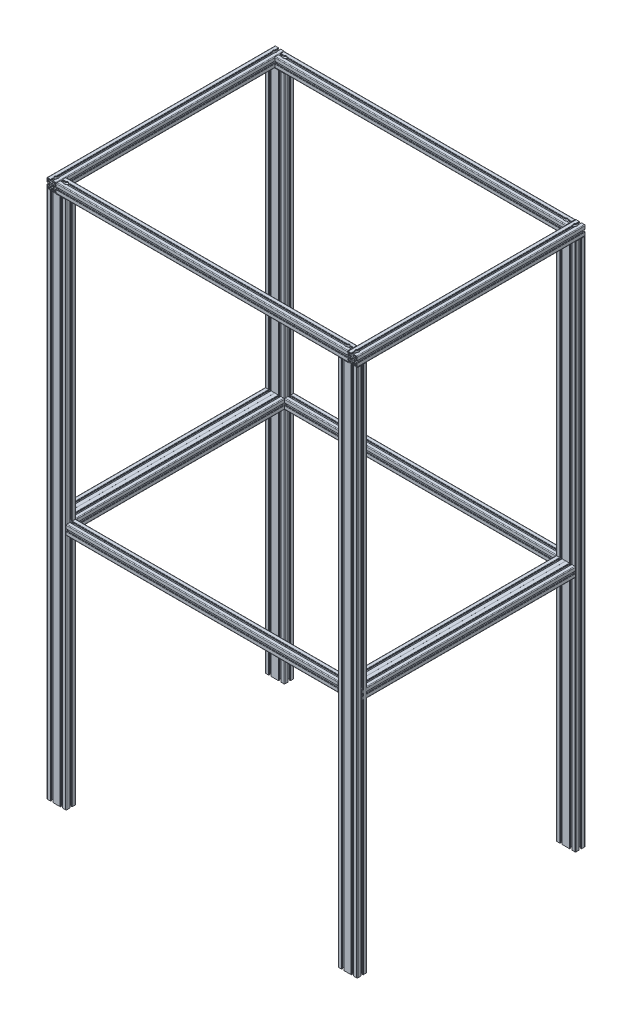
SolidWorks part; units mm, degrees
ref_plane "Ebene vorne" through (0, 0, 0) normal (0, 0, 1) x (1, 0, 0)
ref_plane "Ebene oben" through (0, 0, 0) normal (0, 1, 0) x (1, 0, 0)
ref_plane "Ebene rechts" through (0, 0, 0) normal (1, 0, 0) x (0, 0, -1)
sketch3d "3D-Skizze2"
  line L0 (600, 1200, -450) -> (600, -1000, -450)
  line L1 (-600, 0, 450) -> (-600, 0, -450)
  line L2 (-600, 0, 450) -> (600, 0, 450)
  line L3 (600, 0, 450) -> (600, 0, -450)
  line L4 (-600, 0, -450) -> (600, 0, -450)
  line L5 (-600, 0, 450) -> (600, 0, -450) construction
  line L6 (600, 0, 450) -> (-600, 0, -450) construction
  line L7 (-600, 1200, -450) -> (-600, -1000, -450)
  line L8 (600, 1200, 450) -> (600, -1000, 450)
  line L9 (-600, 1200, 450) -> (-600, -1000, 450)
  line L10 (600, 1200, -450) -> (600, 1200, 450) construction
  line L11 (-600, 1200, -450) -> (-600, 1200, 450) construction
  line L12 (600, 1200, 450) -> (-600, 1200, 450) construction
  line L13 (600, 1200, -450) -> (-600, 1200, -450) construction
  line L14 (-620, 1200, -450) -> (620, 1200, -450)
  line L15 (-620, 1200, 450) -> (620, 1200, 450)
  line L16 (-620, 1200, -450) -> (-620, 1200, 450)
  line L17 (620, 1200, -450) -> (620, 1200, 450)
  line L18 (620, 1200, 450) -> (600, 1200, 450)
  point P0 (0, 0, 0)
  dimension "D1" = 1200
  dimension "D2" = 900
  dimension "D3" = 1000
  dimension "D4" = 2200
  dimension "D5" = 20
  dimension "D6" = 20
other "Strukturbauteil3"
ref_plane "Ebene3" through (-600, 1200, 450) normal (0, -1, 0) x (1, 0, 0)
sketch "Skizze1" plane through (-600, 1200, 450) normal (0, -1, 0) x (1, 0, 0)
  line L0 (-33.5, 16) -> (-31.6865, 16)
  line L1 (-33.508, 16.2) -> (-31.6235, 16.2)
  line L2 (33.5, 16) -> (31.6865, 16)
  line L3 (33.508, 15.8) -> (31.7274, 15.8)
  line L4 (36, 15.8) -> (31.6865, 15.8) construction
  line L5 (36, 16) -> (31.6865, 16) construction
  line L6 (31.6865, -16) -> (33.5, -16)
  line L7 (-16.6, 0) -> (-12.25, 0)
  line L8 (-16.6059, -0.2) -> (-12.25, -0.2)
  line L9 (12.25, 0) -> (16.6, 0)
  line L10 (31.7274, -15.8) -> (33.508, -15.8)
  line L11 (-20, 0) -> (20, 0) construction
  line L12 (-20, -0.2) -> (20, -0.2) construction
  line L13 (12.25, -0.2) -> (16.6059, -0.2)
  line L14 (-33.5061, -15.8) -> (-31.7274, -15.8)
  line L15 (-33.4983, -15.9669) -> (-31.7274, -15.9669)
  line L16 (-31.7274, -15.9669) -> (-31.7274, -17.5)
  line L17 (-12.25, -0.2) -> (-12.25, -4.8728)
  line L18 (12.25, 0) -> (12.25, 6.1155)
  line L19 (0, -17.5) -> (0, -20)
  line L20 (-0.1, -17.5) -> (-0.1, -20)
  line L21 (0, -17.5) -> (2.68, -17.5)
  line L22 (-0.1, -20) -> (-14.9, -20)
  line L122 (-17.1716, 4.2426) -> (-18.4093, 3.0049)
  line L123 (-21.5907, 3.0049) -> (-22.8284, 4.2426)
  line L124 (-24.2426, 2.8284) -> (-23.0049, 1.5907)
  line L125 (-23.0049, -1.5907) -> (-24.2426, -2.8284)
  line L126 (-22.8284, -4.2426) -> (-21.5907, -3.0049)
  line L127 (-18.4093, -3.0049) -> (-17.1716, -4.2426)
  line L128 (-15.7574, -2.8284) -> (-16.9951, -1.5907)
  line L129 (-16.9951, 1.5907) -> (-15.7574, 2.8284)
  line L130 (22.8284, 4.2426) -> (21.5907, 3.0049)
  line L131 (18.4093, 3.0049) -> (17.1716, 4.2426)
  line L132 (15.7574, 2.8284) -> (16.9951, 1.5907)
  line L133 (16.9951, -1.5907) -> (15.7574, -2.8284)
  line L134 (17.1716, -4.2426) -> (18.4093, -3.0049)
  line L135 (21.5907, -3.0049) -> (22.8284, -4.2426)
  line L136 (24.2426, -2.8284) -> (23.0049, -1.5907)
  line L137 (23.0049, 1.5907) -> (24.2426, 2.8284)
  line L138 (26.5, 15.5) -> (24.6, 15.5)
  line L139 (24.1, 16) -> (24.1, 19)
  line L140 (25.1, 20) -> (37, 20)
  line L141 (40, 17) -> (40, 5.1)
  line L142 (39, 4.1) -> (36, 4.1)
  line L143 (35.5, 4.6) -> (35.5, 6.5)
  line L144 (36, 7) -> (37, 7)
  line L145 (37.5, 7.5) -> (37.5, 9.75)
  line L146 (35.5, 11.75) -> (34.5784, 11.75)
  line L147 (33.1642, 11.1642) -> (28.7787, 6.7787)
  line L148 (27.9, 4.6574) -> (27.9, 0.5)
  line L149 (27.9, 0.5) -> (27.4, 0)
  line L150 (27.4, 0) -> (27.9, -0.5)
  line L151 (27.9, -0.5) -> (27.9, -4.6574)
  line L152 (28.7787, -6.7787) -> (33.1642, -11.1642)
  line L153 (34.5784, -11.75) -> (35.5, -11.75)
  line L154 (37.5, -9.75) -> (37.5, -7.5)
  line L155 (37, -7) -> (36, -7)
  line L156 (35.5, -6.5) -> (35.5, -4.6)
  line L157 (36, -4.1) -> (39, -4.1)
  line L158 (40, -5.1) -> (40, -17)
  line L159 (37, -20) -> (25.1, -20)
  line L160 (24.1, -19) -> (24.1, -16)
  line L161 (24.6, -15.5) -> (26.5, -15.5)
  line L162 (27, -16) -> (27, -17)
  line L163 (27.5, -17.5) -> (29.75, -17.5)
  line L164 (31.75, -15.5) -> (31.75, -14.5784)
  line L165 (31.1642, -13.1642) -> (26.7787, -8.7787)
  line L166 (24.6574, -7.9) -> (20.5, -7.9)
  line L167 (20.5, -7.9) -> (20, -7.4)
  line L168 (20, -7.4) -> (19.5, -7.9)
  line L169 (19.5, -7.9) -> (15.3426, -7.9)
  line L170 (13.2213, -8.7787) -> (8.8358, -13.1642)
  line L171 (8.25, -14.5784) -> (8.25, -15.5)
  line L172 (10.25, -17.5) -> (12.5, -17.5)
  line L173 (13, -17) -> (13, -16)
  line L174 (13.5, -15.5) -> (15.4, -15.5)
  line L175 (15.9, -16) -> (15.9, -19)
  line L176 (14.9, -20) -> (0, -20)
  line L177 (-15.9, -19) -> (-15.9, -16)
  line L178 (-15.4, -15.5) -> (-13.5, -15.5)
  line L179 (-13, -16) -> (-13, -17)
  line L180 (-12.5, -17.5) -> (-10.25, -17.5)
  line L181 (-8.25, -15.5) -> (-8.25, -14.5784)
  line L182 (-8.8358, -13.1642) -> (-13.2213, -8.7787)
  line L183 (-15.3426, -7.9) -> (-19.5, -7.9)
  line L184 (-19.5, -7.9) -> (-20, -7.4)
  line L185 (-20, -7.4) -> (-20.5, -7.9)
  line L186 (-20.5, -7.9) -> (-24.6574, -7.9)
  line L187 (-26.7787, -8.7787) -> (-31.1642, -13.1642)
  line L188 (-31.75, -14.5784) -> (-31.75, -15.5)
  line L189 (-31.7274, -17.5) -> (-27.5, -17.5)
  line L190 (-27, -17) -> (-27, -16)
  line L191 (-26.5, -15.5) -> (-24.6, -15.5)
  line L192 (-24.1, -16) -> (-24.1, -19)
  line L193 (-25.1, -20) -> (-37, -20)
  line L194 (-40, -17) -> (-40, -5.1)
  line L195 (-39, -4.1) -> (-36, -4.1)
  line L196 (-35.5, -4.6) -> (-35.5, -6.5)
  line L197 (-36, -7) -> (-37, -7)
  line L198 (-37.5, -7.5) -> (-37.5, -9.75)
  line L199 (-35.5, -11.75) -> (-34.5784, -11.75)
  line L200 (-33.1642, -11.1642) -> (-28.7787, -6.7787)
  line L201 (-27.9, -4.6574) -> (-27.9, -0.5)
  line L202 (-27.9, -0.5) -> (-27.4, 0)
  line L203 (-27.4, 0) -> (-27.9, 0.5)
  line L204 (-27.9, 0.5) -> (-27.9, 4.6574)
  line L205 (-28.7787, 6.7787) -> (-33.1642, 11.1642)
  line L206 (-34.5784, 11.75) -> (-35.5, 11.75)
  line L207 (-37.5, 9.75) -> (-37.5, 7.5)
  line L208 (-37, 7) -> (-36, 7)
  line L209 (-35.5, 6.5) -> (-35.5, 4.6)
  line L210 (-36, 4.1) -> (-39, 4.1)
  line L211 (-40, 5.1) -> (-40, 17)
  line L212 (-37, 20) -> (-25.1, 20)
  line L213 (-24.1, 19) -> (-24.1, 16)
  line L214 (-24.6, 15.5) -> (-26.5, 15.5)
  line L215 (-27, 16) -> (-27, 17)
  line L216 (-27.5, 17.5) -> (-29.75, 17.5)
  line L217 (-31.75, 15.5) -> (-31.75, 14.5784)
  line L218 (-31.1642, 13.1642) -> (-26.7787, 8.7787)
  line L219 (-24.6574, 7.9) -> (-20.5, 7.9)
  line L220 (-20.5, 7.9) -> (-20, 7.4)
  line L221 (-20, 7.4) -> (-19.5, 7.9)
  line L222 (-19.5, 7.9) -> (-15.3426, 7.9)
  line L223 (-13.2213, 8.7787) -> (-8.8358, 13.1642)
  line L224 (-8.25, 14.5784) -> (-8.25, 15.5)
  line L225 (-10.25, 17.5) -> (-12.5, 17.5)
  line L226 (-13, 17) -> (-13, 16)
  line L227 (-13.5, 15.5) -> (-15.4, 15.5)
  line L228 (-15.9, 16) -> (-15.9, 19)
  line L229 (-14.9, 20) -> (14.9, 20)
  line L230 (15.9, 19) -> (15.9, 16)
  line L231 (15.4, 15.5) -> (13.5, 15.5)
  line L232 (13, 16) -> (13, 17)
  line L233 (12.5, 17.5) -> (10.25, 17.5)
  line L234 (8.25, 15.5) -> (8.25, 14.5784)
  line L235 (8.8358, 13.1642) -> (13.2213, 8.7787)
  line L236 (15.3426, 7.9) -> (19.5, 7.9)
  line L237 (19.5, 7.9) -> (20, 7.4)
  line L238 (20, 7.4) -> (20.5, 7.9)
  line L239 (20.5, 7.9) -> (24.6574, 7.9)
  line L240 (26.7787, 8.7787) -> (31.1642, 13.1642)
  line L241 (31.75, 14.5784) -> (31.75, 15.5)
  line L242 (29.75, 17.5) -> (27.5, 17.5)
  line L243 (27, 17) -> (27, 16)
  line L245 (12.25, -6.1155) -> (12.25, -0.2)
  line L257 (5.68, 13.5139) -> (5.68, 14.5)
  line L258 (2.68, 17.5) -> (-2.68, 17.5)
  line L259 (-5.68, 14.5) -> (-5.68, 13.5139)
  line L260 (-6.2658, 12.0997) -> (-11.3713, 6.9942)
  line L261 (-12.25, 4.8728) -> (-12.25, 0)
  line L262 (-11.3713, -6.9942) -> (-6.2658, -12.0997)
  line L263 (-5.68, -13.5139) -> (-5.68, -14.5)
  line L264 (-2.68, -17.5) -> (-0.1, -17.5)
  line L265 (5.68, -14.5) -> (5.68, -13.5139)
  line L266 (6.2658, -12.0997) -> (12.25, -6.1155)
  line L268 (12.25, 6.1155) -> (6.2658, 12.0997)
  arc A0 (-31.6865, 16) -> (-31.75, 15.5) centre (-29.75, 15.5) ccw
  arc A1 (-33.508, 16.2) -> (-33.5, 16) centre (-36, 16) ccw
  arc A2 (33.5, 16) -> (33.508, 15.8) centre (36, 16) cw
  arc A3 (31.6865, 16) -> (29.75, 17.5) centre (29.75, 15.5) ccw
  arc A4 (33.5, -16) -> (33.508, -15.8) centre (36, -16) ccw
  arc A5 (31.7274, -15.8) -> (31.75, -15.5) centre (29.75, -15.5) ccw
  arc A6 (-33.5061, -15.8) -> (-33.4983, -15.9669) centre (-35.9991, -15.9999) ccw
  arc A8 (-16.6, 0) -> (-16.9951, 1.5907) centre (-20, 0) ccw
  arc A9 (16.6059, -0.2) -> (16.9951, -1.5907) centre (20, 0) ccw
  circle A108 centre (36, -16) radius 2.5 construction
  circle A109 centre (36, 16) radius 2.5 construction
  arc A112 (-18.4093, 3.0049) -> (-21.5907, 3.0049) centre (-20, 0) ccw
  arc A113 (-22.8284, 4.2426) -> (-24.2426, 2.8284) centre (-23.5355, 3.5355) ccw
  arc A114 (-23.0049, 1.5907) -> (-23.0049, -1.5907) centre (-20, 0) ccw
  arc A115 (-24.2426, -2.8284) -> (-22.8284, -4.2426) centre (-23.5355, -3.5355) ccw
  arc A116 (-21.5907, -3.0049) -> (-18.4093, -3.0049) centre (-20, 0) ccw
  arc A117 (-17.1716, -4.2426) -> (-15.7574, -2.8284) centre (-16.4645, -3.5355) ccw
  arc A118 (-16.9951, -1.5907) -> (-16.6059, -0.2) centre (-20, 0) ccw
  arc A119 (-15.7574, 2.8284) -> (-17.1716, 4.2426) centre (-16.4645, 3.5355) ccw
  arc A120 (21.5907, 3.0049) -> (18.4093, 3.0049) centre (20, 0) ccw
  arc A121 (17.1716, 4.2426) -> (15.7574, 2.8284) centre (16.4645, 3.5355) ccw
  arc A122 (16.9951, 1.5907) -> (16.6, 0) centre (20, 0) ccw
  arc A123 (15.7574, -2.8284) -> (17.1716, -4.2426) centre (16.4645, -3.5355) ccw
  arc A124 (18.4093, -3.0049) -> (21.5907, -3.0049) centre (20, 0) ccw
  arc A125 (22.8284, -4.2426) -> (24.2426, -2.8284) centre (23.5355, -3.5355) ccw
  arc A126 (23.0049, -1.5907) -> (23.0049, 1.5907) centre (20, 0) ccw
  arc A127 (24.2426, 2.8284) -> (22.8284, 4.2426) centre (23.5355, 3.5355) ccw
  arc A128 (24.1, 16) -> (24.6, 15.5) centre (24.6, 16) ccw
  arc A129 (25.1, 20) -> (24.1, 19) centre (25.1, 19) ccw
  arc A130 (40, 17) -> (37, 20) centre (37, 17) ccw
  arc A131 (39, 4.1) -> (40, 5.1) centre (39, 5.1) ccw
  arc A132 (35.5, 4.6) -> (36, 4.1) centre (36, 4.6) ccw
  arc A133 (36, 7) -> (35.5, 6.5) centre (36, 6.5) ccw
  arc A134 (37, 7) -> (37.5, 7.5) centre (37, 7.5) ccw
  arc A135 (37.5, 9.75) -> (35.5, 11.75) centre (35.5, 9.75) ccw
  arc A136 (34.5784, 11.75) -> (33.1642, 11.1642) centre (34.5784, 9.75) ccw
  arc A137 (28.7787, 6.7787) -> (27.9, 4.6574) centre (30.9, 4.6574) ccw
  arc A138 (27.9, -4.6574) -> (28.7787, -6.7787) centre (30.9, -4.6574) ccw
  arc A139 (33.1642, -11.1642) -> (34.5784, -11.75) centre (34.5784, -9.75) ccw
  arc A140 (35.5, -11.75) -> (37.5, -9.75) centre (35.5, -9.75) ccw
  arc A141 (37.5, -7.5) -> (37, -7) centre (37, -7.5) ccw
  arc A142 (35.5, -6.5) -> (36, -7) centre (36, -6.5) ccw
  arc A143 (36, -4.1) -> (35.5, -4.6) centre (36, -4.6) ccw
  arc A144 (40, -5.1) -> (39, -4.1) centre (39, -5.1) ccw
  arc A145 (37, -20) -> (40, -17) centre (37, -17) ccw
  arc A146 (24.1, -19) -> (25.1, -20) centre (25.1, -19) ccw
  arc A147 (24.6, -15.5) -> (24.1, -16) centre (24.6, -16) ccw
  arc A148 (27, -16) -> (26.5, -15.5) centre (26.5, -16) ccw
  arc A149 (27, -17) -> (27.5, -17.5) centre (27.5, -17) ccw
  arc A150 (29.75, -17.5) -> (31.6865, -16) centre (29.75, -15.5) ccw
  arc A151 (31.75, -14.5784) -> (31.1642, -13.1642) centre (29.75, -14.5784) ccw
  arc A152 (26.7787, -8.7787) -> (24.6574, -7.9) centre (24.6574, -10.9) ccw
  arc A153 (15.3426, -7.9) -> (13.2213, -8.7787) centre (15.3426, -10.9) ccw
  arc A154 (8.8358, -13.1642) -> (8.25, -14.5784) centre (10.25, -14.5784) ccw
  arc A155 (8.25, -15.5) -> (10.25, -17.5) centre (10.25, -15.5) ccw
  arc A156 (12.5, -17.5) -> (13, -17) centre (12.5, -17) ccw
  arc A157 (13.5, -15.5) -> (13, -16) centre (13.5, -16) ccw
  arc A158 (15.9, -16) -> (15.4, -15.5) centre (15.4, -16) ccw
  arc A159 (14.9, -20) -> (15.9, -19) centre (14.9, -19) ccw
  arc A160 (-15.9, -19) -> (-14.9, -20) centre (-14.9, -19) ccw
  arc A161 (-15.4, -15.5) -> (-15.9, -16) centre (-15.4, -16) ccw
  arc A162 (-13, -16) -> (-13.5, -15.5) centre (-13.5, -16) ccw
  arc A163 (-13, -17) -> (-12.5, -17.5) centre (-12.5, -17) ccw
  arc A164 (-10.25, -17.5) -> (-8.25, -15.5) centre (-10.25, -15.5) ccw
  arc A165 (-8.25, -14.5784) -> (-8.8358, -13.1642) centre (-10.25, -14.5784) ccw
  arc A166 (-13.2213, -8.7787) -> (-15.3426, -7.9) centre (-15.3426, -10.9) ccw
  arc A167 (-24.6574, -7.9) -> (-26.7787, -8.7787) centre (-24.6574, -10.9) ccw
  arc A168 (-31.1642, -13.1642) -> (-31.75, -14.5784) centre (-29.75, -14.5784) ccw
  arc A169 (-31.75, -15.5) -> (-31.7274, -15.8) centre (-29.75, -15.5) ccw
  arc A170 (-27.5, -17.5) -> (-27, -17) centre (-27.5, -17) ccw
  arc A171 (-26.5, -15.5) -> (-27, -16) centre (-26.5, -16) ccw
  arc A172 (-24.1, -16) -> (-24.6, -15.5) centre (-24.6, -16) ccw
  arc A173 (-25.1, -20) -> (-24.1, -19) centre (-25.1, -19) ccw
  arc A174 (-40, -17) -> (-37, -20) centre (-37, -17) ccw
  arc A175 (-39, -4.1) -> (-40, -5.1) centre (-39, -5.1) ccw
  arc A176 (-35.5, -4.6) -> (-36, -4.1) centre (-36, -4.6) ccw
  arc A177 (-36, -7) -> (-35.5, -6.5) centre (-36, -6.5) ccw
  arc A178 (-37, -7) -> (-37.5, -7.5) centre (-37, -7.5) ccw
  arc A179 (-37.5, -9.75) -> (-35.5, -11.75) centre (-35.5, -9.75) ccw
  arc A180 (-34.5784, -11.75) -> (-33.1642, -11.1642) centre (-34.5784, -9.75) ccw
  arc A181 (-28.7787, -6.7787) -> (-27.9, -4.6574) centre (-30.9, -4.6574) ccw
  arc A182 (-27.9, 4.6574) -> (-28.7787, 6.7787) centre (-30.9, 4.6574) ccw
  arc A183 (-33.1642, 11.1642) -> (-34.5784, 11.75) centre (-34.5784, 9.75) ccw
  arc A184 (-35.5, 11.75) -> (-37.5, 9.75) centre (-35.5, 9.75) ccw
  arc A185 (-37.5, 7.5) -> (-37, 7) centre (-37, 7.5) ccw
  arc A186 (-35.5, 6.5) -> (-36, 7) centre (-36, 6.5) ccw
  arc A187 (-36, 4.1) -> (-35.5, 4.6) centre (-36, 4.6) ccw
  arc A188 (-40, 5.1) -> (-39, 4.1) centre (-39, 5.1) ccw
  arc A189 (-37, 20) -> (-40, 17) centre (-37, 17) ccw
  arc A190 (-24.1, 19) -> (-25.1, 20) centre (-25.1, 19) ccw
  arc A191 (-24.6, 15.5) -> (-24.1, 16) centre (-24.6, 16) ccw
  arc A192 (-27, 16) -> (-26.5, 15.5) centre (-26.5, 16) ccw
  arc A193 (-27, 17) -> (-27.5, 17.5) centre (-27.5, 17) ccw
  arc A194 (-29.75, 17.5) -> (-31.6235, 16.2) centre (-29.75, 15.5) ccw
  arc A195 (-31.75, 14.5784) -> (-31.1642, 13.1642) centre (-29.75, 14.5784) ccw
  arc A196 (-26.7787, 8.7787) -> (-24.6574, 7.9) centre (-24.6574, 10.9) ccw
  arc A197 (-15.3426, 7.9) -> (-13.2213, 8.7787) centre (-15.3426, 10.9) ccw
  arc A198 (-8.8358, 13.1642) -> (-8.25, 14.5784) centre (-10.25, 14.5784) ccw
  arc A199 (-8.25, 15.5) -> (-10.25, 17.5) centre (-10.25, 15.5) ccw
  arc A200 (-12.5, 17.5) -> (-13, 17) centre (-12.5, 17) ccw
  arc A201 (-13.5, 15.5) -> (-13, 16) centre (-13.5, 16) ccw
  arc A202 (-15.9, 16) -> (-15.4, 15.5) centre (-15.4, 16) ccw
  arc A203 (-14.9, 20) -> (-15.9, 19) centre (-14.9, 19) ccw
  arc A204 (15.9, 19) -> (14.9, 20) centre (14.9, 19) ccw
  arc A205 (15.4, 15.5) -> (15.9, 16) centre (15.4, 16) ccw
  arc A206 (13, 16) -> (13.5, 15.5) centre (13.5, 16) ccw
  arc A207 (13, 17) -> (12.5, 17.5) centre (12.5, 17) ccw
  arc A208 (10.25, 17.5) -> (8.25, 15.5) centre (10.25, 15.5) ccw
  arc A209 (8.25, 14.5784) -> (8.8358, 13.1642) centre (10.25, 14.5784) ccw
  arc A210 (13.2213, 8.7787) -> (15.3426, 7.9) centre (15.3426, 10.9) ccw
  arc A211 (24.6574, 7.9) -> (26.7787, 8.7787) centre (24.6574, 10.9) ccw
  arc A212 (31.1642, 13.1642) -> (31.75, 14.5784) centre (29.75, 14.5784) ccw
  arc A213 (31.75, 15.5) -> (31.7274, 15.8) centre (29.75, 15.5) ccw
  arc A214 (27.5, 17.5) -> (27, 17) centre (27.5, 17) ccw
  arc A215 (26.5, 15.5) -> (27, 16) centre (26.5, 16) ccw
  arc A228 (5.68, 14.5) -> (2.68, 17.5) centre (2.68, 14.5) ccw
  arc A229 (-2.68, 17.5) -> (-5.68, 14.5) centre (-2.68, 14.5) ccw
  arc A230 (-6.2658, 12.0997) -> (-5.68, 13.5139) centre (-7.68, 13.5139) ccw
  arc A231 (-11.3713, 6.9942) -> (-12.25, 4.8728) centre (-9.25, 4.8728) ccw
  arc A232 (-12.25, -4.8728) -> (-11.3713, -6.9942) centre (-9.25, -4.8728) ccw
  arc A233 (-5.68, -13.5139) -> (-6.2658, -12.0997) centre (-7.68, -13.5139) ccw
  arc A234 (-5.68, -14.5) -> (-2.68, -17.5) centre (-2.68, -14.5) ccw
  arc A235 (2.68, -17.5) -> (5.68, -14.5) centre (2.68, -14.5) ccw
  arc A236 (6.2658, -12.0997) -> (5.68, -13.5139) centre (7.68, -13.5139) ccw
  arc A239 (5.68, 13.5139) -> (6.2658, 12.0997) centre (7.68, 13.5139) ccw
  point P334 (0, 0)
  dimension "D1" = 0.2
  dimension "D2" = 0.2
  dimension "D3" = 0.1
other "Strukturbauteil5"
ref_plane "Ebene5" through (-600, 0, 450) normal (0, 0, -1) x (1, 0, 0)
sketch "Skizze13" plane through (-600, 0, 450) normal (0, 0, -1) x (1, 0, 0)
  line L0 (-33.5, 16) -> (-31.6865, 16)
  line L1 (-33.508, 16.2) -> (-31.6235, 16.2)
  line L2 (33.5, 16) -> (31.6865, 16)
  line L3 (33.508, 15.8) -> (31.7274, 15.8)
  line L4 (36, 15.8) -> (31.6865, 15.8) construction
  line L5 (36, 16) -> (31.6865, 16) construction
  line L6 (31.6865, -16) -> (33.5, -16)
  line L7 (-16.6, 0) -> (-12.25, 0)
  line L8 (-16.6059, -0.2) -> (-12.25, -0.2)
  line L9 (12.25, 0) -> (16.6, 0)
  line L10 (31.7274, -15.8) -> (33.508, -15.8)
  line L11 (-20, 0) -> (20, 0) construction
  line L12 (-20, -0.2) -> (20, -0.2) construction
  line L13 (12.25, -0.2) -> (16.6059, -0.2)
  line L14 (-33.5061, -15.8) -> (-31.7274, -15.8)
  line L15 (-33.4983, -15.9669) -> (-31.7274, -15.9669)
  line L16 (-31.7274, -15.9669) -> (-31.7274, -17.5)
  line L17 (-12.25, -0.2) -> (-12.25, -4.8728)
  line L18 (12.25, 0) -> (12.25, 6.1155)
  line L19 (0, -17.5) -> (0, -20)
  line L20 (-0.1, -17.5) -> (-0.1, -20)
  line L21 (0, -17.5) -> (2.68, -17.5)
  line L22 (-0.1, -20) -> (-14.9, -20)
  line L122 (-17.1716, 4.2426) -> (-18.4093, 3.0049)
  line L123 (-21.5907, 3.0049) -> (-22.8284, 4.2426)
  line L124 (-24.2426, 2.8284) -> (-23.0049, 1.5907)
  line L125 (-23.0049, -1.5907) -> (-24.2426, -2.8284)
  line L126 (-22.8284, -4.2426) -> (-21.5907, -3.0049)
  line L127 (-18.4093, -3.0049) -> (-17.1716, -4.2426)
  line L128 (-15.7574, -2.8284) -> (-16.9951, -1.5907)
  line L129 (-16.9951, 1.5907) -> (-15.7574, 2.8284)
  line L130 (22.8284, 4.2426) -> (21.5907, 3.0049)
  line L131 (18.4093, 3.0049) -> (17.1716, 4.2426)
  line L132 (15.7574, 2.8284) -> (16.9951, 1.5907)
  line L133 (16.9951, -1.5907) -> (15.7574, -2.8284)
  line L134 (17.1716, -4.2426) -> (18.4093, -3.0049)
  line L135 (21.5907, -3.0049) -> (22.8284, -4.2426)
  line L136 (24.2426, -2.8284) -> (23.0049, -1.5907)
  line L137 (23.0049, 1.5907) -> (24.2426, 2.8284)
  line L138 (26.5, 15.5) -> (24.6, 15.5)
  line L139 (24.1, 16) -> (24.1, 19)
  line L140 (25.1, 20) -> (37, 20)
  line L141 (40, 17) -> (40, 5.1)
  line L142 (39, 4.1) -> (36, 4.1)
  line L143 (35.5, 4.6) -> (35.5, 6.5)
  line L144 (36, 7) -> (37, 7)
  line L145 (37.5, 7.5) -> (37.5, 9.75)
  line L146 (35.5, 11.75) -> (34.5784, 11.75)
  line L147 (33.1642, 11.1642) -> (28.7787, 6.7787)
  line L148 (27.9, 4.6574) -> (27.9, 0.5)
  line L149 (27.9, 0.5) -> (27.4, 0)
  line L150 (27.4, 0) -> (27.9, -0.5)
  line L151 (27.9, -0.5) -> (27.9, -4.6574)
  line L152 (28.7787, -6.7787) -> (33.1642, -11.1642)
  line L153 (34.5784, -11.75) -> (35.5, -11.75)
  line L154 (37.5, -9.75) -> (37.5, -7.5)
  line L155 (37, -7) -> (36, -7)
  line L156 (35.5, -6.5) -> (35.5, -4.6)
  line L157 (36, -4.1) -> (39, -4.1)
  line L158 (40, -5.1) -> (40, -17)
  line L159 (37, -20) -> (25.1, -20)
  line L160 (24.1, -19) -> (24.1, -16)
  line L161 (24.6, -15.5) -> (26.5, -15.5)
  line L162 (27, -16) -> (27, -17)
  line L163 (27.5, -17.5) -> (29.75, -17.5)
  line L164 (31.75, -15.5) -> (31.75, -14.5784)
  line L165 (31.1642, -13.1642) -> (26.7787, -8.7787)
  line L166 (24.6574, -7.9) -> (20.5, -7.9)
  line L167 (20.5, -7.9) -> (20, -7.4)
  line L168 (20, -7.4) -> (19.5, -7.9)
  line L169 (19.5, -7.9) -> (15.3426, -7.9)
  line L170 (13.2213, -8.7787) -> (8.8358, -13.1642)
  line L171 (8.25, -14.5784) -> (8.25, -15.5)
  line L172 (10.25, -17.5) -> (12.5, -17.5)
  line L173 (13, -17) -> (13, -16)
  line L174 (13.5, -15.5) -> (15.4, -15.5)
  line L175 (15.9, -16) -> (15.9, -19)
  line L176 (14.9, -20) -> (0, -20)
  line L177 (-15.9, -19) -> (-15.9, -16)
  line L178 (-15.4, -15.5) -> (-13.5, -15.5)
  line L179 (-13, -16) -> (-13, -17)
  line L180 (-12.5, -17.5) -> (-10.25, -17.5)
  line L181 (-8.25, -15.5) -> (-8.25, -14.5784)
  line L182 (-8.8358, -13.1642) -> (-13.2213, -8.7787)
  line L183 (-15.3426, -7.9) -> (-19.5, -7.9)
  line L184 (-19.5, -7.9) -> (-20, -7.4)
  line L185 (-20, -7.4) -> (-20.5, -7.9)
  line L186 (-20.5, -7.9) -> (-24.6574, -7.9)
  line L187 (-26.7787, -8.7787) -> (-31.1642, -13.1642)
  line L188 (-31.75, -14.5784) -> (-31.75, -15.5)
  line L189 (-31.7274, -17.5) -> (-27.5, -17.5)
  line L190 (-27, -17) -> (-27, -16)
  line L191 (-26.5, -15.5) -> (-24.6, -15.5)
  line L192 (-24.1, -16) -> (-24.1, -19)
  line L193 (-25.1, -20) -> (-37, -20)
  line L194 (-40, -17) -> (-40, -5.1)
  line L195 (-39, -4.1) -> (-36, -4.1)
  line L196 (-35.5, -4.6) -> (-35.5, -6.5)
  line L197 (-36, -7) -> (-37, -7)
  line L198 (-37.5, -7.5) -> (-37.5, -9.75)
  line L199 (-35.5, -11.75) -> (-34.5784, -11.75)
  line L200 (-33.1642, -11.1642) -> (-28.7787, -6.7787)
  line L201 (-27.9, -4.6574) -> (-27.9, -0.5)
  line L202 (-27.9, -0.5) -> (-27.4, 0)
  line L203 (-27.4, 0) -> (-27.9, 0.5)
  line L204 (-27.9, 0.5) -> (-27.9, 4.6574)
  line L205 (-28.7787, 6.7787) -> (-33.1642, 11.1642)
  line L206 (-34.5784, 11.75) -> (-35.5, 11.75)
  line L207 (-37.5, 9.75) -> (-37.5, 7.5)
  line L208 (-37, 7) -> (-36, 7)
  line L209 (-35.5, 6.5) -> (-35.5, 4.6)
  line L210 (-36, 4.1) -> (-39, 4.1)
  line L211 (-40, 5.1) -> (-40, 17)
  line L212 (-37, 20) -> (-25.1, 20)
  line L213 (-24.1, 19) -> (-24.1, 16)
  line L214 (-24.6, 15.5) -> (-26.5, 15.5)
  line L215 (-27, 16) -> (-27, 17)
  line L216 (-27.5, 17.5) -> (-29.75, 17.5)
  line L217 (-31.75, 15.5) -> (-31.75, 14.5784)
  line L218 (-31.1642, 13.1642) -> (-26.7787, 8.7787)
  line L219 (-24.6574, 7.9) -> (-20.5, 7.9)
  line L220 (-20.5, 7.9) -> (-20, 7.4)
  line L221 (-20, 7.4) -> (-19.5, 7.9)
  line L222 (-19.5, 7.9) -> (-15.3426, 7.9)
  line L223 (-13.2213, 8.7787) -> (-8.8358, 13.1642)
  line L224 (-8.25, 14.5784) -> (-8.25, 15.5)
  line L225 (-10.25, 17.5) -> (-12.5, 17.5)
  line L226 (-13, 17) -> (-13, 16)
  line L227 (-13.5, 15.5) -> (-15.4, 15.5)
  line L228 (-15.9, 16) -> (-15.9, 19)
  line L229 (-14.9, 20) -> (14.9, 20)
  line L230 (15.9, 19) -> (15.9, 16)
  line L231 (15.4, 15.5) -> (13.5, 15.5)
  line L232 (13, 16) -> (13, 17)
  line L233 (12.5, 17.5) -> (10.25, 17.5)
  line L234 (8.25, 15.5) -> (8.25, 14.5784)
  line L235 (8.8358, 13.1642) -> (13.2213, 8.7787)
  line L236 (15.3426, 7.9) -> (19.5, 7.9)
  line L237 (19.5, 7.9) -> (20, 7.4)
  line L238 (20, 7.4) -> (20.5, 7.9)
  line L239 (20.5, 7.9) -> (24.6574, 7.9)
  line L240 (26.7787, 8.7787) -> (31.1642, 13.1642)
  line L241 (31.75, 14.5784) -> (31.75, 15.5)
  line L242 (29.75, 17.5) -> (27.5, 17.5)
  line L243 (27, 17) -> (27, 16)
  line L245 (12.25, -6.1155) -> (12.25, -0.2)
  line L257 (5.68, 13.5139) -> (5.68, 14.5)
  line L258 (2.68, 17.5) -> (-2.68, 17.5)
  line L259 (-5.68, 14.5) -> (-5.68, 13.5139)
  line L260 (-6.2658, 12.0997) -> (-11.3713, 6.9942)
  line L261 (-12.25, 4.8728) -> (-12.25, 0)
  line L262 (-11.3713, -6.9942) -> (-6.2658, -12.0997)
  line L263 (-5.68, -13.5139) -> (-5.68, -14.5)
  line L264 (-2.68, -17.5) -> (-0.1, -17.5)
  line L265 (5.68, -14.5) -> (5.68, -13.5139)
  line L266 (6.2658, -12.0997) -> (12.25, -6.1155)
  line L268 (12.25, 6.1155) -> (6.2658, 12.0997)
  arc A0 (-31.6865, 16) -> (-31.75, 15.5) centre (-29.75, 15.5) ccw
  arc A1 (-33.508, 16.2) -> (-33.5, 16) centre (-36, 16) ccw
  arc A2 (33.5, 16) -> (33.508, 15.8) centre (36, 16) cw
  arc A3 (31.6865, 16) -> (29.75, 17.5) centre (29.75, 15.5) ccw
  arc A4 (33.5, -16) -> (33.508, -15.8) centre (36, -16) ccw
  arc A5 (31.7274, -15.8) -> (31.75, -15.5) centre (29.75, -15.5) ccw
  arc A6 (-33.5061, -15.8) -> (-33.4983, -15.9669) centre (-35.9991, -15.9999) ccw
  arc A8 (-16.6, 0) -> (-16.9951, 1.5907) centre (-20, 0) ccw
  arc A9 (16.6059, -0.2) -> (16.9951, -1.5907) centre (20, 0) ccw
  circle A108 centre (36, -16) radius 2.5 construction
  circle A109 centre (36, 16) radius 2.5 construction
  arc A112 (-18.4093, 3.0049) -> (-21.5907, 3.0049) centre (-20, 0) ccw
  arc A113 (-22.8284, 4.2426) -> (-24.2426, 2.8284) centre (-23.5355, 3.5355) ccw
  arc A114 (-23.0049, 1.5907) -> (-23.0049, -1.5907) centre (-20, 0) ccw
  arc A115 (-24.2426, -2.8284) -> (-22.8284, -4.2426) centre (-23.5355, -3.5355) ccw
  arc A116 (-21.5907, -3.0049) -> (-18.4093, -3.0049) centre (-20, 0) ccw
  arc A117 (-17.1716, -4.2426) -> (-15.7574, -2.8284) centre (-16.4645, -3.5355) ccw
  arc A118 (-16.9951, -1.5907) -> (-16.6059, -0.2) centre (-20, 0) ccw
  arc A119 (-15.7574, 2.8284) -> (-17.1716, 4.2426) centre (-16.4645, 3.5355) ccw
  arc A120 (21.5907, 3.0049) -> (18.4093, 3.0049) centre (20, 0) ccw
  arc A121 (17.1716, 4.2426) -> (15.7574, 2.8284) centre (16.4645, 3.5355) ccw
  arc A122 (16.9951, 1.5907) -> (16.6, 0) centre (20, 0) ccw
  arc A123 (15.7574, -2.8284) -> (17.1716, -4.2426) centre (16.4645, -3.5355) ccw
  arc A124 (18.4093, -3.0049) -> (21.5907, -3.0049) centre (20, 0) ccw
  arc A125 (22.8284, -4.2426) -> (24.2426, -2.8284) centre (23.5355, -3.5355) ccw
  arc A126 (23.0049, -1.5907) -> (23.0049, 1.5907) centre (20, 0) ccw
  arc A127 (24.2426, 2.8284) -> (22.8284, 4.2426) centre (23.5355, 3.5355) ccw
  arc A128 (24.1, 16) -> (24.6, 15.5) centre (24.6, 16) ccw
  arc A129 (25.1, 20) -> (24.1, 19) centre (25.1, 19) ccw
  arc A130 (40, 17) -> (37, 20) centre (37, 17) ccw
  arc A131 (39, 4.1) -> (40, 5.1) centre (39, 5.1) ccw
  arc A132 (35.5, 4.6) -> (36, 4.1) centre (36, 4.6) ccw
  arc A133 (36, 7) -> (35.5, 6.5) centre (36, 6.5) ccw
  arc A134 (37, 7) -> (37.5, 7.5) centre (37, 7.5) ccw
  arc A135 (37.5, 9.75) -> (35.5, 11.75) centre (35.5, 9.75) ccw
  arc A136 (34.5784, 11.75) -> (33.1642, 11.1642) centre (34.5784, 9.75) ccw
  arc A137 (28.7787, 6.7787) -> (27.9, 4.6574) centre (30.9, 4.6574) ccw
  arc A138 (27.9, -4.6574) -> (28.7787, -6.7787) centre (30.9, -4.6574) ccw
  arc A139 (33.1642, -11.1642) -> (34.5784, -11.75) centre (34.5784, -9.75) ccw
  arc A140 (35.5, -11.75) -> (37.5, -9.75) centre (35.5, -9.75) ccw
  arc A141 (37.5, -7.5) -> (37, -7) centre (37, -7.5) ccw
  arc A142 (35.5, -6.5) -> (36, -7) centre (36, -6.5) ccw
  arc A143 (36, -4.1) -> (35.5, -4.6) centre (36, -4.6) ccw
  arc A144 (40, -5.1) -> (39, -4.1) centre (39, -5.1) ccw
  arc A145 (37, -20) -> (40, -17) centre (37, -17) ccw
  arc A146 (24.1, -19) -> (25.1, -20) centre (25.1, -19) ccw
  arc A147 (24.6, -15.5) -> (24.1, -16) centre (24.6, -16) ccw
  arc A148 (27, -16) -> (26.5, -15.5) centre (26.5, -16) ccw
  arc A149 (27, -17) -> (27.5, -17.5) centre (27.5, -17) ccw
  arc A150 (29.75, -17.5) -> (31.6865, -16) centre (29.75, -15.5) ccw
  arc A151 (31.75, -14.5784) -> (31.1642, -13.1642) centre (29.75, -14.5784) ccw
  arc A152 (26.7787, -8.7787) -> (24.6574, -7.9) centre (24.6574, -10.9) ccw
  arc A153 (15.3426, -7.9) -> (13.2213, -8.7787) centre (15.3426, -10.9) ccw
  arc A154 (8.8358, -13.1642) -> (8.25, -14.5784) centre (10.25, -14.5784) ccw
  arc A155 (8.25, -15.5) -> (10.25, -17.5) centre (10.25, -15.5) ccw
  arc A156 (12.5, -17.5) -> (13, -17) centre (12.5, -17) ccw
  arc A157 (13.5, -15.5) -> (13, -16) centre (13.5, -16) ccw
  arc A158 (15.9, -16) -> (15.4, -15.5) centre (15.4, -16) ccw
  arc A159 (14.9, -20) -> (15.9, -19) centre (14.9, -19) ccw
  arc A160 (-15.9, -19) -> (-14.9, -20) centre (-14.9, -19) ccw
  arc A161 (-15.4, -15.5) -> (-15.9, -16) centre (-15.4, -16) ccw
  arc A162 (-13, -16) -> (-13.5, -15.5) centre (-13.5, -16) ccw
  arc A163 (-13, -17) -> (-12.5, -17.5) centre (-12.5, -17) ccw
  arc A164 (-10.25, -17.5) -> (-8.25, -15.5) centre (-10.25, -15.5) ccw
  arc A165 (-8.25, -14.5784) -> (-8.8358, -13.1642) centre (-10.25, -14.5784) ccw
  arc A166 (-13.2213, -8.7787) -> (-15.3426, -7.9) centre (-15.3426, -10.9) ccw
  arc A167 (-24.6574, -7.9) -> (-26.7787, -8.7787) centre (-24.6574, -10.9) ccw
  arc A168 (-31.1642, -13.1642) -> (-31.75, -14.5784) centre (-29.75, -14.5784) ccw
  arc A169 (-31.75, -15.5) -> (-31.7274, -15.8) centre (-29.75, -15.5) ccw
  arc A170 (-27.5, -17.5) -> (-27, -17) centre (-27.5, -17) ccw
  arc A171 (-26.5, -15.5) -> (-27, -16) centre (-26.5, -16) ccw
  arc A172 (-24.1, -16) -> (-24.6, -15.5) centre (-24.6, -16) ccw
  arc A173 (-25.1, -20) -> (-24.1, -19) centre (-25.1, -19) ccw
  arc A174 (-40, -17) -> (-37, -20) centre (-37, -17) ccw
  arc A175 (-39, -4.1) -> (-40, -5.1) centre (-39, -5.1) ccw
  arc A176 (-35.5, -4.6) -> (-36, -4.1) centre (-36, -4.6) ccw
  arc A177 (-36, -7) -> (-35.5, -6.5) centre (-36, -6.5) ccw
  arc A178 (-37, -7) -> (-37.5, -7.5) centre (-37, -7.5) ccw
  arc A179 (-37.5, -9.75) -> (-35.5, -11.75) centre (-35.5, -9.75) ccw
  arc A180 (-34.5784, -11.75) -> (-33.1642, -11.1642) centre (-34.5784, -9.75) ccw
  arc A181 (-28.7787, -6.7787) -> (-27.9, -4.6574) centre (-30.9, -4.6574) ccw
  arc A182 (-27.9, 4.6574) -> (-28.7787, 6.7787) centre (-30.9, 4.6574) ccw
  arc A183 (-33.1642, 11.1642) -> (-34.5784, 11.75) centre (-34.5784, 9.75) ccw
  arc A184 (-35.5, 11.75) -> (-37.5, 9.75) centre (-35.5, 9.75) ccw
  arc A185 (-37.5, 7.5) -> (-37, 7) centre (-37, 7.5) ccw
  arc A186 (-35.5, 6.5) -> (-36, 7) centre (-36, 6.5) ccw
  arc A187 (-36, 4.1) -> (-35.5, 4.6) centre (-36, 4.6) ccw
  arc A188 (-40, 5.1) -> (-39, 4.1) centre (-39, 5.1) ccw
  arc A189 (-37, 20) -> (-40, 17) centre (-37, 17) ccw
  arc A190 (-24.1, 19) -> (-25.1, 20) centre (-25.1, 19) ccw
  arc A191 (-24.6, 15.5) -> (-24.1, 16) centre (-24.6, 16) ccw
  arc A192 (-27, 16) -> (-26.5, 15.5) centre (-26.5, 16) ccw
  arc A193 (-27, 17) -> (-27.5, 17.5) centre (-27.5, 17) ccw
  arc A194 (-29.75, 17.5) -> (-31.6235, 16.2) centre (-29.75, 15.5) ccw
  arc A195 (-31.75, 14.5784) -> (-31.1642, 13.1642) centre (-29.75, 14.5784) ccw
  arc A196 (-26.7787, 8.7787) -> (-24.6574, 7.9) centre (-24.6574, 10.9) ccw
  arc A197 (-15.3426, 7.9) -> (-13.2213, 8.7787) centre (-15.3426, 10.9) ccw
  arc A198 (-8.8358, 13.1642) -> (-8.25, 14.5784) centre (-10.25, 14.5784) ccw
  arc A199 (-8.25, 15.5) -> (-10.25, 17.5) centre (-10.25, 15.5) ccw
  arc A200 (-12.5, 17.5) -> (-13, 17) centre (-12.5, 17) ccw
  arc A201 (-13.5, 15.5) -> (-13, 16) centre (-13.5, 16) ccw
  arc A202 (-15.9, 16) -> (-15.4, 15.5) centre (-15.4, 16) ccw
  arc A203 (-14.9, 20) -> (-15.9, 19) centre (-14.9, 19) ccw
  arc A204 (15.9, 19) -> (14.9, 20) centre (14.9, 19) ccw
  arc A205 (15.4, 15.5) -> (15.9, 16) centre (15.4, 16) ccw
  arc A206 (13, 16) -> (13.5, 15.5) centre (13.5, 16) ccw
  arc A207 (13, 17) -> (12.5, 17.5) centre (12.5, 17) ccw
  arc A208 (10.25, 17.5) -> (8.25, 15.5) centre (10.25, 15.5) ccw
  arc A209 (8.25, 14.5784) -> (8.8358, 13.1642) centre (10.25, 14.5784) ccw
  arc A210 (13.2213, 8.7787) -> (15.3426, 7.9) centre (15.3426, 10.9) ccw
  arc A211 (24.6574, 7.9) -> (26.7787, 8.7787) centre (24.6574, 10.9) ccw
  arc A212 (31.1642, 13.1642) -> (31.75, 14.5784) centre (29.75, 14.5784) ccw
  arc A213 (31.75, 15.5) -> (31.7274, 15.8) centre (29.75, 15.5) ccw
  arc A214 (27.5, 17.5) -> (27, 17) centre (27.5, 17) ccw
  arc A215 (26.5, 15.5) -> (27, 16) centre (26.5, 16) ccw
  arc A228 (5.68, 14.5) -> (2.68, 17.5) centre (2.68, 14.5) ccw
  arc A229 (-2.68, 17.5) -> (-5.68, 14.5) centre (-2.68, 14.5) ccw
  arc A230 (-6.2658, 12.0997) -> (-5.68, 13.5139) centre (-7.68, 13.5139) ccw
  arc A231 (-11.3713, 6.9942) -> (-12.25, 4.8728) centre (-9.25, 4.8728) ccw
  arc A232 (-12.25, -4.8728) -> (-11.3713, -6.9942) centre (-9.25, -4.8728) ccw
  arc A233 (-5.68, -13.5139) -> (-6.2658, -12.0997) centre (-7.68, -13.5139) ccw
  arc A234 (-5.68, -14.5) -> (-2.68, -17.5) centre (-2.68, -14.5) ccw
  arc A235 (2.68, -17.5) -> (5.68, -14.5) centre (2.68, -14.5) ccw
  arc A236 (6.2658, -12.0997) -> (5.68, -13.5139) centre (7.68, -13.5139) ccw
  arc A239 (5.68, 13.5139) -> (6.2658, 12.0997) centre (7.68, 13.5139) ccw
  point P334 (0, 0)
  dimension "D1" = 0.2
  dimension "D2" = 0.2
  dimension "D3" = 0.1
other "Strukturbauteil6"
ref_plane "Ebene7" through (-600, 0, 450) normal (1, 0, 0) x (0, 0, -1)
sketch "Skizze15" plane through (-600, 0, 450) normal (1, 0, 0) x (0, 0, -1)
  line L81 (6.5, 15.5) -> (4.6, 15.5)
  line L82 (4.1, 16) -> (4.1, 19)
  line L83 (5.1, 20) -> (17, 20)
  line L84 (20, 17) -> (20, 5.1)
  line L85 (19, 4.1) -> (16, 4.1)
  line L86 (15.5, 4.6) -> (15.5, 6.5)
  line L87 (16, 7) -> (17, 7)
  line L88 (17.5, 7.5) -> (17.5, 9.75)
  line L89 (15.5, 11.75) -> (14.5784, 11.75)
  line L90 (13.1642, 11.1642) -> (8.7787, 6.7787)
  line L91 (7.9, 4.6574) -> (7.9, 0.5)
  line L92 (7.9, 0.5) -> (7.4, 0)
  line L93 (7.4, 0) -> (7.9, -0.5)
  line L94 (7.9, -0.5) -> (7.9, -4.6574)
  line L95 (8.7787, -6.7787) -> (13.1642, -11.1642)
  line L96 (14.5784, -11.75) -> (15.5, -11.75)
  line L97 (17.5, -9.75) -> (17.5, -7.5)
  line L98 (17, -7) -> (16, -7)
  line L99 (15.5, -6.5) -> (15.5, -4.6)
  line L100 (16, -4.1) -> (19, -4.1)
  line L101 (20, -5.1) -> (20, -17)
  line L102 (17, -20) -> (5.1, -20)
  line L103 (4.1, -19) -> (4.1, -16)
  line L104 (4.6, -15.5) -> (6.5, -15.5)
  line L105 (7, -16) -> (7, -17)
  line L106 (7.5, -17.5) -> (9.75, -17.5)
  line L107 (11.75, -15.5) -> (11.75, -14.5784)
  line L108 (11.1642, -13.1642) -> (6.7787, -8.7787)
  line L109 (4.6574, -7.9) -> (0.5, -7.9)
  line L110 (0.5, -7.9) -> (0, -7.4)
  line L111 (0, -7.4) -> (-0.5, -7.9)
  line L112 (-0.5, -7.9) -> (-4.6574, -7.9)
  line L113 (-6.7787, -8.7787) -> (-11.1642, -13.1642)
  line L114 (-11.75, -14.5784) -> (-11.75, -15.5)
  line L115 (-9.75, -17.5) -> (-7.5, -17.5)
  line L116 (-7, -17) -> (-7, -16)
  line L117 (-6.5, -15.5) -> (-4.6, -15.5)
  line L118 (-4.1, -16) -> (-4.1, -19)
  line L119 (-5.1, -20) -> (-17, -20)
  line L120 (-20, -17) -> (-20, -5.1)
  line L121 (-19, -4.1) -> (-16, -4.1)
  line L122 (-15.5, -4.6) -> (-15.5, -6.5)
  line L123 (-16, -7) -> (-17, -7)
  line L124 (-17.5, -7.5) -> (-17.5, -9.75)
  line L125 (-15.5, -11.75) -> (-14.5784, -11.75)
  line L126 (-13.1642, -11.1642) -> (-8.7787, -6.7787)
  line L127 (-7.9, -4.6574) -> (-7.9, -0.5)
  line L128 (-7.9, -0.5) -> (-7.4, 0)
  line L129 (-7.4, 0) -> (-7.9, 0.5)
  line L130 (-7.9, 0.5) -> (-7.9, 4.6574)
  line L131 (-8.7787, 6.7787) -> (-13.1642, 11.1642)
  line L132 (-14.5784, 11.75) -> (-15.5, 11.75)
  line L133 (-17.5, 9.75) -> (-17.5, 7.5)
  line L134 (-17, 7) -> (-16, 7)
  line L135 (-15.5, 6.5) -> (-15.5, 4.6)
  line L136 (-16, 4.1) -> (-19, 4.1)
  line L137 (-20, 5.1) -> (-20, 17)
  line L138 (-17, 20) -> (-5.1, 20)
  line L139 (-4.1, 19) -> (-4.1, 16)
  line L140 (-4.6, 15.5) -> (-6.5, 15.5)
  line L141 (-7, 16) -> (-7, 17)
  line L142 (-7.5, 17.5) -> (-9.75, 17.5)
  line L143 (-11.75, 15.5) -> (-11.75, 14.5784)
  line L144 (-11.1642, 13.1642) -> (-6.7787, 8.7787)
  line L145 (-4.6574, 7.9) -> (-0.5, 7.9)
  line L146 (-0.5, 7.9) -> (0, 7.4)
  line L147 (0, 7.4) -> (0.5, 7.9)
  line L148 (0.5, 7.9) -> (4.6574, 7.9)
  line L149 (6.7787, 8.7787) -> (11.1642, 13.1642)
  line L150 (11.75, 14.5784) -> (11.75, 15.5)
  line L151 (9.75, 17.5) -> (7.5, 17.5)
  line L152 (7, 17) -> (7, 16)
  line L153 (2.8284, 4.2426) -> (1.5907, 3.0049)
  line L154 (-1.5907, 3.0049) -> (-2.8284, 4.2426)
  line L155 (-4.2426, 2.8284) -> (-3.0049, 1.5907)
  line L156 (-3.0049, -1.5907) -> (-4.2426, -2.8284)
  line L157 (-2.8284, -4.2426) -> (-1.5907, -3.0049)
  line L158 (1.5907, -3.0049) -> (2.8284, -4.2426)
  line L159 (4.2426, -2.8284) -> (3.0049, -1.5907)
  line L160 (3.0049, 1.5907) -> (4.2426, 2.8284)
  circle A5 centre (-16, 16) radius 2.5
  circle A6 centre (16, 16) radius 2.5
  circle A7 centre (16, -16) radius 2.5
  circle A8 centre (-16, -16) radius 2.5
  arc A77 (6.5, 15.5) -> (7, 16) centre (6.5, 16) ccw
  arc A78 (4.1, 16) -> (4.6, 15.5) centre (4.6, 16) ccw
  arc A79 (5.1, 20) -> (4.1, 19) centre (5.1, 19) ccw
  arc A80 (20, 17) -> (17, 20) centre (17, 17) ccw
  arc A81 (19, 4.1) -> (20, 5.1) centre (19, 5.1) ccw
  arc A82 (15.5, 4.6) -> (16, 4.1) centre (16, 4.6) ccw
  arc A83 (16, 7) -> (15.5, 6.5) centre (16, 6.5) ccw
  arc A84 (17, 7) -> (17.5, 7.5) centre (17, 7.5) ccw
  arc A85 (17.5, 9.75) -> (15.5, 11.75) centre (15.5, 9.75) ccw
  arc A86 (14.5784, 11.75) -> (13.1642, 11.1642) centre (14.5784, 9.75) ccw
  arc A87 (8.7787, 6.7787) -> (7.9, 4.6574) centre (10.9, 4.6574) ccw
  arc A88 (7.9, -4.6574) -> (8.7787, -6.7787) centre (10.9, -4.6574) ccw
  arc A89 (13.1642, -11.1642) -> (14.5784, -11.75) centre (14.5784, -9.75) ccw
  arc A90 (15.5, -11.75) -> (17.5, -9.75) centre (15.5, -9.75) ccw
  arc A91 (17.5, -7.5) -> (17, -7) centre (17, -7.5) ccw
  arc A92 (15.5, -6.5) -> (16, -7) centre (16, -6.5) ccw
  arc A93 (16, -4.1) -> (15.5, -4.6) centre (16, -4.6) ccw
  arc A94 (20, -5.1) -> (19, -4.1) centre (19, -5.1) ccw
  arc A95 (17, -20) -> (20, -17) centre (17, -17) ccw
  arc A96 (4.1, -19) -> (5.1, -20) centre (5.1, -19) ccw
  arc A97 (4.6, -15.5) -> (4.1, -16) centre (4.6, -16) ccw
  arc A98 (7, -16) -> (6.5, -15.5) centre (6.5, -16) ccw
  arc A99 (7, -17) -> (7.5, -17.5) centre (7.5, -17) ccw
  arc A100 (9.75, -17.5) -> (11.75, -15.5) centre (9.75, -15.5) ccw
  arc A101 (11.75, -14.5784) -> (11.1642, -13.1642) centre (9.75, -14.5784) ccw
  arc A102 (6.7787, -8.7787) -> (4.6574, -7.9) centre (4.6574, -10.9) ccw
  arc A103 (-4.6574, -7.9) -> (-6.7787, -8.7787) centre (-4.6574, -10.9) ccw
  arc A104 (-11.1642, -13.1642) -> (-11.75, -14.5784) centre (-9.75, -14.5784) ccw
  arc A105 (-11.75, -15.5) -> (-9.75, -17.5) centre (-9.75, -15.5) ccw
  arc A106 (-7.5, -17.5) -> (-7, -17) centre (-7.5, -17) ccw
  arc A107 (-6.5, -15.5) -> (-7, -16) centre (-6.5, -16) ccw
  arc A108 (-4.1, -16) -> (-4.6, -15.5) centre (-4.6, -16) ccw
  arc A109 (-5.1, -20) -> (-4.1, -19) centre (-5.1, -19) ccw
  arc A110 (-20, -17) -> (-17, -20) centre (-17, -17) ccw
  arc A111 (-19, -4.1) -> (-20, -5.1) centre (-19, -5.1) ccw
  arc A112 (-15.5, -4.6) -> (-16, -4.1) centre (-16, -4.6) ccw
  arc A113 (-16, -7) -> (-15.5, -6.5) centre (-16, -6.5) ccw
  arc A114 (-17, -7) -> (-17.5, -7.5) centre (-17, -7.5) ccw
  arc A115 (-17.5, -9.75) -> (-15.5, -11.75) centre (-15.5, -9.75) ccw
  arc A116 (-14.5784, -11.75) -> (-13.1642, -11.1642) centre (-14.5784, -9.75) ccw
  arc A117 (-8.7787, -6.7787) -> (-7.9, -4.6574) centre (-10.9, -4.6574) ccw
  arc A118 (-7.9, 4.6574) -> (-8.7787, 6.7787) centre (-10.9, 4.6574) ccw
  arc A119 (-13.1642, 11.1642) -> (-14.5784, 11.75) centre (-14.5784, 9.75) ccw
  arc A120 (-15.5, 11.75) -> (-17.5, 9.75) centre (-15.5, 9.75) ccw
  arc A121 (-17.5, 7.5) -> (-17, 7) centre (-17, 7.5) ccw
  arc A122 (-15.5, 6.5) -> (-16, 7) centre (-16, 6.5) ccw
  arc A123 (-16, 4.1) -> (-15.5, 4.6) centre (-16, 4.6) ccw
  arc A124 (-20, 5.1) -> (-19, 4.1) centre (-19, 5.1) ccw
  arc A125 (-17, 20) -> (-20, 17) centre (-17, 17) ccw
  arc A126 (-4.1, 19) -> (-5.1, 20) centre (-5.1, 19) ccw
  arc A127 (-4.6, 15.5) -> (-4.1, 16) centre (-4.6, 16) ccw
  arc A128 (-7, 16) -> (-6.5, 15.5) centre (-6.5, 16) ccw
  arc A129 (-7, 17) -> (-7.5, 17.5) centre (-7.5, 17) ccw
  arc A130 (-9.75, 17.5) -> (-11.75, 15.5) centre (-9.75, 15.5) ccw
  arc A131 (-11.75, 14.5784) -> (-11.1642, 13.1642) centre (-9.75, 14.5784) ccw
  arc A132 (-6.7787, 8.7787) -> (-4.6574, 7.9) centre (-4.6574, 10.9) ccw
  arc A133 (4.6574, 7.9) -> (6.7787, 8.7787) centre (4.6574, 10.9) ccw
  arc A134 (11.1642, 13.1642) -> (11.75, 14.5784) centre (9.75, 14.5784) ccw
  arc A135 (11.75, 15.5) -> (9.75, 17.5) centre (9.75, 15.5) ccw
  arc A136 (7.5, 17.5) -> (7, 17) centre (7.5, 17) ccw
  arc A137 (1.5907, 3.0049) -> (-1.5907, 3.0049) centre (0, 0) ccw
  arc A138 (-2.8284, 4.2426) -> (-4.2426, 2.8284) centre (-3.5355, 3.5355) ccw
  arc A139 (-3.0049, 1.5907) -> (-3.0049, -1.5907) centre (0, 0) ccw
  arc A140 (-4.2426, -2.8284) -> (-2.8284, -4.2426) centre (-3.5355, -3.5355) ccw
  arc A141 (-1.5907, -3.0049) -> (1.5907, -3.0049) centre (0, 0) ccw
  arc A142 (2.8284, -4.2426) -> (4.2426, -2.8284) centre (3.5355, -3.5355) ccw
  arc A143 (3.0049, -1.5907) -> (3.0049, 1.5907) centre (0, 0) ccw
  arc A144 (4.2426, 2.8284) -> (2.8284, 4.2426) centre (3.5355, 3.5355) ccw
  point P1 (0, 0)
other "Strukturbauteil7"
ref_plane "Ebene8" through (-620, 1200, -450) normal (1, 0, 0) x (0, 0, -1)
sketch "Skizze16" plane through (-620, 1200, -450) normal (1, 0, 0) x (0, 0, -1)
  line L81 (6.5, 15.5) -> (4.6, 15.5)
  line L82 (4.1, 16) -> (4.1, 19)
  line L83 (5.1, 20) -> (17, 20)
  line L84 (20, 17) -> (20, 5.1)
  line L85 (19, 4.1) -> (16, 4.1)
  line L86 (15.5, 4.6) -> (15.5, 6.5)
  line L87 (16, 7) -> (17, 7)
  line L88 (17.5, 7.5) -> (17.5, 9.75)
  line L89 (15.5, 11.75) -> (14.5784, 11.75)
  line L90 (13.1642, 11.1642) -> (8.7787, 6.7787)
  line L91 (7.9, 4.6574) -> (7.9, 0.5)
  line L92 (7.9, 0.5) -> (7.4, 0)
  line L93 (7.4, 0) -> (7.9, -0.5)
  line L94 (7.9, -0.5) -> (7.9, -4.6574)
  line L95 (8.7787, -6.7787) -> (13.1642, -11.1642)
  line L96 (14.5784, -11.75) -> (15.5, -11.75)
  line L97 (17.5, -9.75) -> (17.5, -7.5)
  line L98 (17, -7) -> (16, -7)
  line L99 (15.5, -6.5) -> (15.5, -4.6)
  line L100 (16, -4.1) -> (19, -4.1)
  line L101 (20, -5.1) -> (20, -17)
  line L102 (17, -20) -> (5.1, -20)
  line L103 (4.1, -19) -> (4.1, -16)
  line L104 (4.6, -15.5) -> (6.5, -15.5)
  line L105 (7, -16) -> (7, -17)
  line L106 (7.5, -17.5) -> (9.75, -17.5)
  line L107 (11.75, -15.5) -> (11.75, -14.5784)
  line L108 (11.1642, -13.1642) -> (6.7787, -8.7787)
  line L109 (4.6574, -7.9) -> (0.5, -7.9)
  line L110 (0.5, -7.9) -> (0, -7.4)
  line L111 (0, -7.4) -> (-0.5, -7.9)
  line L112 (-0.5, -7.9) -> (-4.6574, -7.9)
  line L113 (-6.7787, -8.7787) -> (-11.1642, -13.1642)
  line L114 (-11.75, -14.5784) -> (-11.75, -15.5)
  line L115 (-9.75, -17.5) -> (-7.5, -17.5)
  line L116 (-7, -17) -> (-7, -16)
  line L117 (-6.5, -15.5) -> (-4.6, -15.5)
  line L118 (-4.1, -16) -> (-4.1, -19)
  line L119 (-5.1, -20) -> (-17, -20)
  line L120 (-20, -17) -> (-20, -5.1)
  line L121 (-19, -4.1) -> (-16, -4.1)
  line L122 (-15.5, -4.6) -> (-15.5, -6.5)
  line L123 (-16, -7) -> (-17, -7)
  line L124 (-17.5, -7.5) -> (-17.5, -9.75)
  line L125 (-15.5, -11.75) -> (-14.5784, -11.75)
  line L126 (-13.1642, -11.1642) -> (-8.7787, -6.7787)
  line L127 (-7.9, -4.6574) -> (-7.9, -0.5)
  line L128 (-7.9, -0.5) -> (-7.4, 0)
  line L129 (-7.4, 0) -> (-7.9, 0.5)
  line L130 (-7.9, 0.5) -> (-7.9, 4.6574)
  line L131 (-8.7787, 6.7787) -> (-13.1642, 11.1642)
  line L132 (-14.5784, 11.75) -> (-15.5, 11.75)
  line L133 (-17.5, 9.75) -> (-17.5, 7.5)
  line L134 (-17, 7) -> (-16, 7)
  line L135 (-15.5, 6.5) -> (-15.5, 4.6)
  line L136 (-16, 4.1) -> (-19, 4.1)
  line L137 (-20, 5.1) -> (-20, 17)
  line L138 (-17, 20) -> (-5.1, 20)
  line L139 (-4.1, 19) -> (-4.1, 16)
  line L140 (-4.6, 15.5) -> (-6.5, 15.5)
  line L141 (-7, 16) -> (-7, 17)
  line L142 (-7.5, 17.5) -> (-9.75, 17.5)
  line L143 (-11.75, 15.5) -> (-11.75, 14.5784)
  line L144 (-11.1642, 13.1642) -> (-6.7787, 8.7787)
  line L145 (-4.6574, 7.9) -> (-0.5, 7.9)
  line L146 (-0.5, 7.9) -> (0, 7.4)
  line L147 (0, 7.4) -> (0.5, 7.9)
  line L148 (0.5, 7.9) -> (4.6574, 7.9)
  line L149 (6.7787, 8.7787) -> (11.1642, 13.1642)
  line L150 (11.75, 14.5784) -> (11.75, 15.5)
  line L151 (9.75, 17.5) -> (7.5, 17.5)
  line L152 (7, 17) -> (7, 16)
  line L153 (2.8284, 4.2426) -> (1.5907, 3.0049)
  line L154 (-1.5907, 3.0049) -> (-2.8284, 4.2426)
  line L155 (-4.2426, 2.8284) -> (-3.0049, 1.5907)
  line L156 (-3.0049, -1.5907) -> (-4.2426, -2.8284)
  line L157 (-2.8284, -4.2426) -> (-1.5907, -3.0049)
  line L158 (1.5907, -3.0049) -> (2.8284, -4.2426)
  line L159 (4.2426, -2.8284) -> (3.0049, -1.5907)
  line L160 (3.0049, 1.5907) -> (4.2426, 2.8284)
  circle A5 centre (-16, 16) radius 2.5
  circle A6 centre (16, 16) radius 2.5
  circle A7 centre (16, -16) radius 2.5
  circle A8 centre (-16, -16) radius 2.5
  arc A77 (6.5, 15.5) -> (7, 16) centre (6.5, 16) ccw
  arc A78 (4.1, 16) -> (4.6, 15.5) centre (4.6, 16) ccw
  arc A79 (5.1, 20) -> (4.1, 19) centre (5.1, 19) ccw
  arc A80 (20, 17) -> (17, 20) centre (17, 17) ccw
  arc A81 (19, 4.1) -> (20, 5.1) centre (19, 5.1) ccw
  arc A82 (15.5, 4.6) -> (16, 4.1) centre (16, 4.6) ccw
  arc A83 (16, 7) -> (15.5, 6.5) centre (16, 6.5) ccw
  arc A84 (17, 7) -> (17.5, 7.5) centre (17, 7.5) ccw
  arc A85 (17.5, 9.75) -> (15.5, 11.75) centre (15.5, 9.75) ccw
  arc A86 (14.5784, 11.75) -> (13.1642, 11.1642) centre (14.5784, 9.75) ccw
  arc A87 (8.7787, 6.7787) -> (7.9, 4.6574) centre (10.9, 4.6574) ccw
  arc A88 (7.9, -4.6574) -> (8.7787, -6.7787) centre (10.9, -4.6574) ccw
  arc A89 (13.1642, -11.1642) -> (14.5784, -11.75) centre (14.5784, -9.75) ccw
  arc A90 (15.5, -11.75) -> (17.5, -9.75) centre (15.5, -9.75) ccw
  arc A91 (17.5, -7.5) -> (17, -7) centre (17, -7.5) ccw
  arc A92 (15.5, -6.5) -> (16, -7) centre (16, -6.5) ccw
  arc A93 (16, -4.1) -> (15.5, -4.6) centre (16, -4.6) ccw
  arc A94 (20, -5.1) -> (19, -4.1) centre (19, -5.1) ccw
  arc A95 (17, -20) -> (20, -17) centre (17, -17) ccw
  arc A96 (4.1, -19) -> (5.1, -20) centre (5.1, -19) ccw
  arc A97 (4.6, -15.5) -> (4.1, -16) centre (4.6, -16) ccw
  arc A98 (7, -16) -> (6.5, -15.5) centre (6.5, -16) ccw
  arc A99 (7, -17) -> (7.5, -17.5) centre (7.5, -17) ccw
  arc A100 (9.75, -17.5) -> (11.75, -15.5) centre (9.75, -15.5) ccw
  arc A101 (11.75, -14.5784) -> (11.1642, -13.1642) centre (9.75, -14.5784) ccw
  arc A102 (6.7787, -8.7787) -> (4.6574, -7.9) centre (4.6574, -10.9) ccw
  arc A103 (-4.6574, -7.9) -> (-6.7787, -8.7787) centre (-4.6574, -10.9) ccw
  arc A104 (-11.1642, -13.1642) -> (-11.75, -14.5784) centre (-9.75, -14.5784) ccw
  arc A105 (-11.75, -15.5) -> (-9.75, -17.5) centre (-9.75, -15.5) ccw
  arc A106 (-7.5, -17.5) -> (-7, -17) centre (-7.5, -17) ccw
  arc A107 (-6.5, -15.5) -> (-7, -16) centre (-6.5, -16) ccw
  arc A108 (-4.1, -16) -> (-4.6, -15.5) centre (-4.6, -16) ccw
  arc A109 (-5.1, -20) -> (-4.1, -19) centre (-5.1, -19) ccw
  arc A110 (-20, -17) -> (-17, -20) centre (-17, -17) ccw
  arc A111 (-19, -4.1) -> (-20, -5.1) centre (-19, -5.1) ccw
  arc A112 (-15.5, -4.6) -> (-16, -4.1) centre (-16, -4.6) ccw
  arc A113 (-16, -7) -> (-15.5, -6.5) centre (-16, -6.5) ccw
  arc A114 (-17, -7) -> (-17.5, -7.5) centre (-17, -7.5) ccw
  arc A115 (-17.5, -9.75) -> (-15.5, -11.75) centre (-15.5, -9.75) ccw
  arc A116 (-14.5784, -11.75) -> (-13.1642, -11.1642) centre (-14.5784, -9.75) ccw
  arc A117 (-8.7787, -6.7787) -> (-7.9, -4.6574) centre (-10.9, -4.6574) ccw
  arc A118 (-7.9, 4.6574) -> (-8.7787, 6.7787) centre (-10.9, 4.6574) ccw
  arc A119 (-13.1642, 11.1642) -> (-14.5784, 11.75) centre (-14.5784, 9.75) ccw
  arc A120 (-15.5, 11.75) -> (-17.5, 9.75) centre (-15.5, 9.75) ccw
  arc A121 (-17.5, 7.5) -> (-17, 7) centre (-17, 7.5) ccw
  arc A122 (-15.5, 6.5) -> (-16, 7) centre (-16, 6.5) ccw
  arc A123 (-16, 4.1) -> (-15.5, 4.6) centre (-16, 4.6) ccw
  arc A124 (-20, 5.1) -> (-19, 4.1) centre (-19, 5.1) ccw
  arc A125 (-17, 20) -> (-20, 17) centre (-17, 17) ccw
  arc A126 (-4.1, 19) -> (-5.1, 20) centre (-5.1, 19) ccw
  arc A127 (-4.6, 15.5) -> (-4.1, 16) centre (-4.6, 16) ccw
  arc A128 (-7, 16) -> (-6.5, 15.5) centre (-6.5, 16) ccw
  arc A129 (-7, 17) -> (-7.5, 17.5) centre (-7.5, 17) ccw
  arc A130 (-9.75, 17.5) -> (-11.75, 15.5) centre (-9.75, 15.5) ccw
  arc A131 (-11.75, 14.5784) -> (-11.1642, 13.1642) centre (-9.75, 14.5784) ccw
  arc A132 (-6.7787, 8.7787) -> (-4.6574, 7.9) centre (-4.6574, 10.9) ccw
  arc A133 (4.6574, 7.9) -> (6.7787, 8.7787) centre (4.6574, 10.9) ccw
  arc A134 (11.1642, 13.1642) -> (11.75, 14.5784) centre (9.75, 14.5784) ccw
  arc A135 (11.75, 15.5) -> (9.75, 17.5) centre (9.75, 15.5) ccw
  arc A136 (7.5, 17.5) -> (7, 17) centre (7.5, 17) ccw
  arc A137 (1.5907, 3.0049) -> (-1.5907, 3.0049) centre (0, 0) ccw
  arc A138 (-2.8284, 4.2426) -> (-4.2426, 2.8284) centre (-3.5355, 3.5355) ccw
  arc A139 (-3.0049, 1.5907) -> (-3.0049, -1.5907) centre (0, 0) ccw
  arc A140 (-4.2426, -2.8284) -> (-2.8284, -4.2426) centre (-3.5355, -3.5355) ccw
  arc A141 (-1.5907, -3.0049) -> (1.5907, -3.0049) centre (0, 0) ccw
  arc A142 (2.8284, -4.2426) -> (4.2426, -2.8284) centre (3.5355, -3.5355) ccw
  arc A143 (3.0049, -1.5907) -> (3.0049, 1.5907) centre (0, 0) ccw
  arc A144 (4.2426, 2.8284) -> (2.8284, 4.2426) centre (3.5355, 3.5355) ccw
  point P1 (0, 0)
other "Strukturbauteil8"
ref_plane "Ebene9" through (-620, 1200, -450) normal (0, 0, 1) x (1, 0, 0)
sketch "Skizze17" plane through (-620, 1200, -450) normal (0, 0, 1) x (1, 0, 0)
  line L81 (6.5, 15.5) -> (4.6, 15.5)
  line L82 (4.1, 16) -> (4.1, 19)
  line L83 (5.1, 20) -> (17, 20)
  line L84 (20, 17) -> (20, 5.1)
  line L85 (19, 4.1) -> (16, 4.1)
  line L86 (15.5, 4.6) -> (15.5, 6.5)
  line L87 (16, 7) -> (17, 7)
  line L88 (17.5, 7.5) -> (17.5, 9.75)
  line L89 (15.5, 11.75) -> (14.5784, 11.75)
  line L90 (13.1642, 11.1642) -> (8.7787, 6.7787)
  line L91 (7.9, 4.6574) -> (7.9, 0.5)
  line L92 (7.9, 0.5) -> (7.4, 0)
  line L93 (7.4, 0) -> (7.9, -0.5)
  line L94 (7.9, -0.5) -> (7.9, -4.6574)
  line L95 (8.7787, -6.7787) -> (13.1642, -11.1642)
  line L96 (14.5784, -11.75) -> (15.5, -11.75)
  line L97 (17.5, -9.75) -> (17.5, -7.5)
  line L98 (17, -7) -> (16, -7)
  line L99 (15.5, -6.5) -> (15.5, -4.6)
  line L100 (16, -4.1) -> (19, -4.1)
  line L101 (20, -5.1) -> (20, -17)
  line L102 (17, -20) -> (5.1, -20)
  line L103 (4.1, -19) -> (4.1, -16)
  line L104 (4.6, -15.5) -> (6.5, -15.5)
  line L105 (7, -16) -> (7, -17)
  line L106 (7.5, -17.5) -> (9.75, -17.5)
  line L107 (11.75, -15.5) -> (11.75, -14.5784)
  line L108 (11.1642, -13.1642) -> (6.7787, -8.7787)
  line L109 (4.6574, -7.9) -> (0.5, -7.9)
  line L110 (0.5, -7.9) -> (0, -7.4)
  line L111 (0, -7.4) -> (-0.5, -7.9)
  line L112 (-0.5, -7.9) -> (-4.6574, -7.9)
  line L113 (-6.7787, -8.7787) -> (-11.1642, -13.1642)
  line L114 (-11.75, -14.5784) -> (-11.75, -15.5)
  line L115 (-9.75, -17.5) -> (-7.5, -17.5)
  line L116 (-7, -17) -> (-7, -16)
  line L117 (-6.5, -15.5) -> (-4.6, -15.5)
  line L118 (-4.1, -16) -> (-4.1, -19)
  line L119 (-5.1, -20) -> (-17, -20)
  line L120 (-20, -17) -> (-20, -5.1)
  line L121 (-19, -4.1) -> (-16, -4.1)
  line L122 (-15.5, -4.6) -> (-15.5, -6.5)
  line L123 (-16, -7) -> (-17, -7)
  line L124 (-17.5, -7.5) -> (-17.5, -9.75)
  line L125 (-15.5, -11.75) -> (-14.5784, -11.75)
  line L126 (-13.1642, -11.1642) -> (-8.7787, -6.7787)
  line L127 (-7.9, -4.6574) -> (-7.9, -0.5)
  line L128 (-7.9, -0.5) -> (-7.4, 0)
  line L129 (-7.4, 0) -> (-7.9, 0.5)
  line L130 (-7.9, 0.5) -> (-7.9, 4.6574)
  line L131 (-8.7787, 6.7787) -> (-13.1642, 11.1642)
  line L132 (-14.5784, 11.75) -> (-15.5, 11.75)
  line L133 (-17.5, 9.75) -> (-17.5, 7.5)
  line L134 (-17, 7) -> (-16, 7)
  line L135 (-15.5, 6.5) -> (-15.5, 4.6)
  line L136 (-16, 4.1) -> (-19, 4.1)
  line L137 (-20, 5.1) -> (-20, 17)
  line L138 (-17, 20) -> (-5.1, 20)
  line L139 (-4.1, 19) -> (-4.1, 16)
  line L140 (-4.6, 15.5) -> (-6.5, 15.5)
  line L141 (-7, 16) -> (-7, 17)
  line L142 (-7.5, 17.5) -> (-9.75, 17.5)
  line L143 (-11.75, 15.5) -> (-11.75, 14.5784)
  line L144 (-11.1642, 13.1642) -> (-6.7787, 8.7787)
  line L145 (-4.6574, 7.9) -> (-0.5, 7.9)
  line L146 (-0.5, 7.9) -> (0, 7.4)
  line L147 (0, 7.4) -> (0.5, 7.9)
  line L148 (0.5, 7.9) -> (4.6574, 7.9)
  line L149 (6.7787, 8.7787) -> (11.1642, 13.1642)
  line L150 (11.75, 14.5784) -> (11.75, 15.5)
  line L151 (9.75, 17.5) -> (7.5, 17.5)
  line L152 (7, 17) -> (7, 16)
  line L153 (2.8284, 4.2426) -> (1.5907, 3.0049)
  line L154 (-1.5907, 3.0049) -> (-2.8284, 4.2426)
  line L155 (-4.2426, 2.8284) -> (-3.0049, 1.5907)
  line L156 (-3.0049, -1.5907) -> (-4.2426, -2.8284)
  line L157 (-2.8284, -4.2426) -> (-1.5907, -3.0049)
  line L158 (1.5907, -3.0049) -> (2.8284, -4.2426)
  line L159 (4.2426, -2.8284) -> (3.0049, -1.5907)
  line L160 (3.0049, 1.5907) -> (4.2426, 2.8284)
  circle A5 centre (-16, 16) radius 2.5
  circle A6 centre (16, 16) radius 2.5
  circle A7 centre (16, -16) radius 2.5
  circle A8 centre (-16, -16) radius 2.5
  arc A77 (6.5, 15.5) -> (7, 16) centre (6.5, 16) ccw
  arc A78 (4.1, 16) -> (4.6, 15.5) centre (4.6, 16) ccw
  arc A79 (5.1, 20) -> (4.1, 19) centre (5.1, 19) ccw
  arc A80 (20, 17) -> (17, 20) centre (17, 17) ccw
  arc A81 (19, 4.1) -> (20, 5.1) centre (19, 5.1) ccw
  arc A82 (15.5, 4.6) -> (16, 4.1) centre (16, 4.6) ccw
  arc A83 (16, 7) -> (15.5, 6.5) centre (16, 6.5) ccw
  arc A84 (17, 7) -> (17.5, 7.5) centre (17, 7.5) ccw
  arc A85 (17.5, 9.75) -> (15.5, 11.75) centre (15.5, 9.75) ccw
  arc A86 (14.5784, 11.75) -> (13.1642, 11.1642) centre (14.5784, 9.75) ccw
  arc A87 (8.7787, 6.7787) -> (7.9, 4.6574) centre (10.9, 4.6574) ccw
  arc A88 (7.9, -4.6574) -> (8.7787, -6.7787) centre (10.9, -4.6574) ccw
  arc A89 (13.1642, -11.1642) -> (14.5784, -11.75) centre (14.5784, -9.75) ccw
  arc A90 (15.5, -11.75) -> (17.5, -9.75) centre (15.5, -9.75) ccw
  arc A91 (17.5, -7.5) -> (17, -7) centre (17, -7.5) ccw
  arc A92 (15.5, -6.5) -> (16, -7) centre (16, -6.5) ccw
  arc A93 (16, -4.1) -> (15.5, -4.6) centre (16, -4.6) ccw
  arc A94 (20, -5.1) -> (19, -4.1) centre (19, -5.1) ccw
  arc A95 (17, -20) -> (20, -17) centre (17, -17) ccw
  arc A96 (4.1, -19) -> (5.1, -20) centre (5.1, -19) ccw
  arc A97 (4.6, -15.5) -> (4.1, -16) centre (4.6, -16) ccw
  arc A98 (7, -16) -> (6.5, -15.5) centre (6.5, -16) ccw
  arc A99 (7, -17) -> (7.5, -17.5) centre (7.5, -17) ccw
  arc A100 (9.75, -17.5) -> (11.75, -15.5) centre (9.75, -15.5) ccw
  arc A101 (11.75, -14.5784) -> (11.1642, -13.1642) centre (9.75, -14.5784) ccw
  arc A102 (6.7787, -8.7787) -> (4.6574, -7.9) centre (4.6574, -10.9) ccw
  arc A103 (-4.6574, -7.9) -> (-6.7787, -8.7787) centre (-4.6574, -10.9) ccw
  arc A104 (-11.1642, -13.1642) -> (-11.75, -14.5784) centre (-9.75, -14.5784) ccw
  arc A105 (-11.75, -15.5) -> (-9.75, -17.5) centre (-9.75, -15.5) ccw
  arc A106 (-7.5, -17.5) -> (-7, -17) centre (-7.5, -17) ccw
  arc A107 (-6.5, -15.5) -> (-7, -16) centre (-6.5, -16) ccw
  arc A108 (-4.1, -16) -> (-4.6, -15.5) centre (-4.6, -16) ccw
  arc A109 (-5.1, -20) -> (-4.1, -19) centre (-5.1, -19) ccw
  arc A110 (-20, -17) -> (-17, -20) centre (-17, -17) ccw
  arc A111 (-19, -4.1) -> (-20, -5.1) centre (-19, -5.1) ccw
  arc A112 (-15.5, -4.6) -> (-16, -4.1) centre (-16, -4.6) ccw
  arc A113 (-16, -7) -> (-15.5, -6.5) centre (-16, -6.5) ccw
  arc A114 (-17, -7) -> (-17.5, -7.5) centre (-17, -7.5) ccw
  arc A115 (-17.5, -9.75) -> (-15.5, -11.75) centre (-15.5, -9.75) ccw
  arc A116 (-14.5784, -11.75) -> (-13.1642, -11.1642) centre (-14.5784, -9.75) ccw
  arc A117 (-8.7787, -6.7787) -> (-7.9, -4.6574) centre (-10.9, -4.6574) ccw
  arc A118 (-7.9, 4.6574) -> (-8.7787, 6.7787) centre (-10.9, 4.6574) ccw
  arc A119 (-13.1642, 11.1642) -> (-14.5784, 11.75) centre (-14.5784, 9.75) ccw
  arc A120 (-15.5, 11.75) -> (-17.5, 9.75) centre (-15.5, 9.75) ccw
  arc A121 (-17.5, 7.5) -> (-17, 7) centre (-17, 7.5) ccw
  arc A122 (-15.5, 6.5) -> (-16, 7) centre (-16, 6.5) ccw
  arc A123 (-16, 4.1) -> (-15.5, 4.6) centre (-16, 4.6) ccw
  arc A124 (-20, 5.1) -> (-19, 4.1) centre (-19, 5.1) ccw
  arc A125 (-17, 20) -> (-20, 17) centre (-17, 17) ccw
  arc A126 (-4.1, 19) -> (-5.1, 20) centre (-5.1, 19) ccw
  arc A127 (-4.6, 15.5) -> (-4.1, 16) centre (-4.6, 16) ccw
  arc A128 (-7, 16) -> (-6.5, 15.5) centre (-6.5, 16) ccw
  arc A129 (-7, 17) -> (-7.5, 17.5) centre (-7.5, 17) ccw
  arc A130 (-9.75, 17.5) -> (-11.75, 15.5) centre (-9.75, 15.5) ccw
  arc A131 (-11.75, 14.5784) -> (-11.1642, 13.1642) centre (-9.75, 14.5784) ccw
  arc A132 (-6.7787, 8.7787) -> (-4.6574, 7.9) centre (-4.6574, 10.9) ccw
  arc A133 (4.6574, 7.9) -> (6.7787, 8.7787) centre (4.6574, 10.9) ccw
  arc A134 (11.1642, 13.1642) -> (11.75, 14.5784) centre (9.75, 14.5784) ccw
  arc A135 (11.75, 15.5) -> (9.75, 17.5) centre (9.75, 15.5) ccw
  arc A136 (7.5, 17.5) -> (7, 17) centre (7.5, 17) ccw
  arc A137 (1.5907, 3.0049) -> (-1.5907, 3.0049) centre (0, 0) ccw
  arc A138 (-2.8284, 4.2426) -> (-4.2426, 2.8284) centre (-3.5355, 3.5355) ccw
  arc A139 (-3.0049, 1.5907) -> (-3.0049, -1.5907) centre (0, 0) ccw
  arc A140 (-4.2426, -2.8284) -> (-2.8284, -4.2426) centre (-3.5355, -3.5355) ccw
  arc A141 (-1.5907, -3.0049) -> (1.5907, -3.0049) centre (0, 0) ccw
  arc A142 (2.8284, -4.2426) -> (4.2426, -2.8284) centre (3.5355, -3.5355) ccw
  arc A143 (3.0049, -1.5907) -> (3.0049, 1.5907) centre (0, 0) ccw
  arc A144 (4.2426, 2.8284) -> (2.8284, 4.2426) centre (3.5355, 3.5355) ccw
  point P1 (0, 0)
other "Trimmen/Verlängern6"
other "Trimmen/Verlängern7"
other "Trimmen/Verlängern8"
other "Trimmen/Verlängern9"
other "Trimmen/Verlängern10"
other "Trimmen/Verlängern11"
other "Trimmen/Verlängern12"
other "Trimmen/Verlängern13"
other "Trimmen/Verlängern14"
other "Trimmen/Verlängern15"
other "Trimmen/Verlängern17"
other "Trimmen/Verlängern18"
other "Trimmen/Verlängern19"
other "Trimmen/Verlängern20"
other "Trimmen/Verlängern21"
other "Trimmen/Verlängern22"
hole_wizard "Stirnsenkung für M8 Zylinderschraube mit Innensechskant1" positions "Skizze22" profile "Skizze21" counterbore size "M8" standard "DIN"
sketch "Skizze22" plane through (0, 1220, 0) normal (0, 1, 0) x (-1, 0, 0)
  point P1 (620, 450)
  point P4 (580, 450)
sketch "Skizze21" plane through (-620, 1220, 450) normal (1, 0, 0) x (0, 0, 1)
  line L0 (0, 0) -> (0, 2220)
  line L1 (0, 2220) -> (4.5, 2220)
  line L3 (4.5, 2220) -> (4.5, 21)
  line L4 (4.5, 21) -> (7.5, 21)
  line L5 (7.5, 21) -> (7.5, 0)
  line L7 (7.5, 0) -> (0, 0)
  line L11 (0, -6.35) -> (0, 107.95) construction
  dimension "Bohrerdurchmesser" = 9
  dimension "Bohrungstiefe" = 2220
  dimension "Senkdurchmesser2" = 15
  dimension "Senktiefe2" = 21
hole_wizard "Stirnsenkung für M8 Zylinderschraube mit Innensechskant2" positions "Skizze24" profile "Skizze23" counterbore size "M8" standard "DIN"
sketch "Skizze24" plane through (0, 1220, 0) normal (0, 1, 0) x (-1, 0, 0)
  point P1 (620, -450)
  point P4 (580, -450)
sketch "Skizze23" plane through (-620, 1220, -450) normal (1, 0, 0) x (0, 0, 1)
  line L0 (0, 0) -> (0, 2220)
  line L1 (0, 2220) -> (4.5, 2220)
  line L3 (4.5, 2220) -> (4.5, 21)
  line L4 (4.5, 21) -> (7.5, 21)
  line L5 (7.5, 21) -> (7.5, 0)
  line L7 (7.5, 0) -> (0, 0)
  line L11 (0, -6.35) -> (0, 107.95) construction
  dimension "Bohrerdurchmesser" = 9
  dimension "Bohrungstiefe" = 2220
  dimension "Senkdurchmesser2" = 15
  dimension "Senktiefe2" = 21
hole_wizard "Stirnsenkung für M8 Zylinderschraube mit Innensechskant3" positions "Skizze26" profile "Skizze25" counterbore size "M8" standard "DIN"
sketch "Skizze26" plane through (0, 1220, 0) normal (0, 1, 0) x (-1, 0, 0)
  point P1 (-580, -450)
  point P4 (-620, -450)
sketch "Skizze25" plane through (580, 1220, -450) normal (1, 0, 0) x (0, 0, 1)
  line L0 (0, 0) -> (0, 2220)
  line L1 (0, 2220) -> (4.5, 2220)
  line L3 (4.5, 2220) -> (4.5, 21)
  line L4 (4.5, 21) -> (7.5, 21)
  line L5 (7.5, 21) -> (7.5, 0)
  line L7 (7.5, 0) -> (0, 0)
  line L11 (0, -6.35) -> (0, 107.95) construction
  dimension "Bohrerdurchmesser" = 9
  dimension "Bohrungstiefe" = 2220
  dimension "Senkdurchmesser2" = 15
  dimension "Senktiefe2" = 21
hole_wizard "Stirnsenkung für M8 Zylinderschraube mit Innensechskant4" positions "Skizze28" profile "Skizze27" counterbore size "M8" standard "DIN"
sketch "Skizze28" plane through (0, 1220, 0) normal (0, 1, 0) x (-1, 0, 0)
  point P1 (-580, 450)
  point P4 (-620, 450)
sketch "Skizze27" plane through (580, 1220, 450) normal (1, 0, 0) x (0, 0, 1)
  line L0 (0, 0) -> (0, 2220)
  line L1 (0, 2220) -> (4.5, 2220)
  line L3 (4.5, 2220) -> (4.5, 21)
  line L4 (4.5, 21) -> (7.5, 21)
  line L5 (7.5, 21) -> (7.5, 0)
  line L7 (7.5, 0) -> (0, 0)
  line L11 (0, -6.35) -> (0, 107.95) construction
  dimension "Bohrerdurchmesser" = 9
  dimension "Bohrungstiefe" = 2220
  dimension "Senkdurchmesser2" = 15
  dimension "Senktiefe2" = 21
